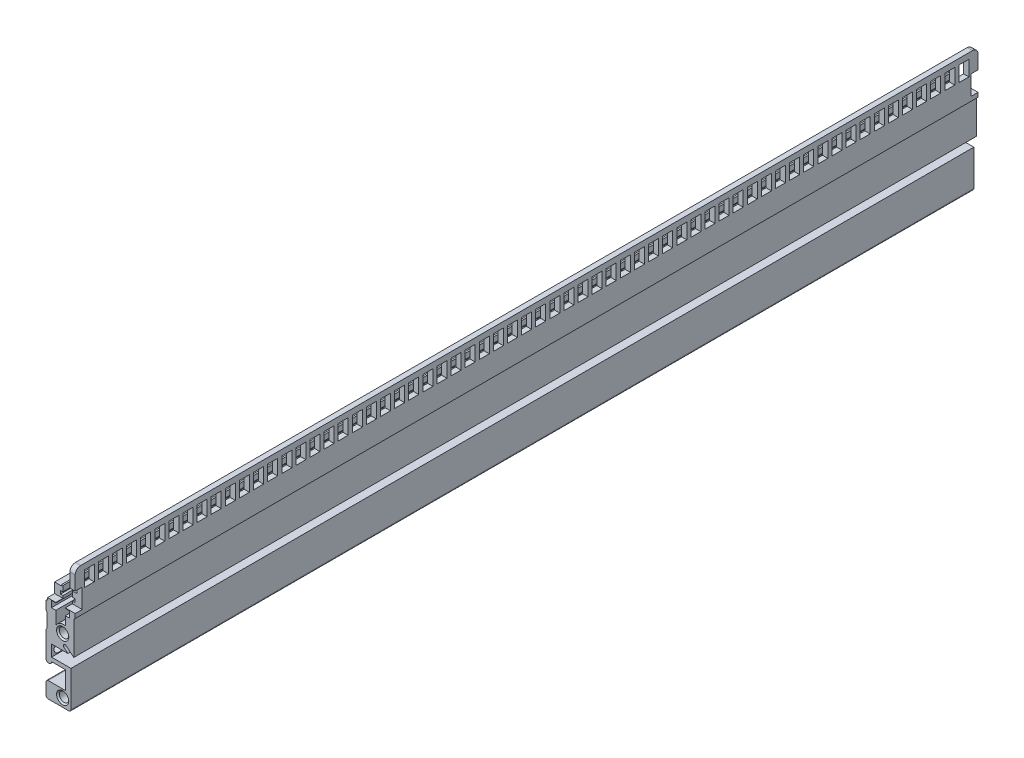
SolidWorks part; units mm, degrees
ref_plane "前视基准面" through (0, 0, 0) normal (0, 0, 1) x (1, 0, 0)
ref_plane "上视基准面" through (0, 0, 0) normal (0, 1, 0) x (1, 0, 0)
ref_plane "右视基准面" through (0, 0, 0) normal (1, 0, 0) x (0, 0, -1)
sketch "草图1" plane through (0, 0, 0) normal (0, 0, 1) x (1, 0, 0)
  line L0 (2.6, 12.5) -> (2.6, 22.5)
  line L1 (0.95, 12.5) -> (2.6, 12.5)
  line L2 (2.6, 22.5) -> (4.5, 22.5)
  line L3 (0.95, 10.55) -> (0.95, 12.5)
  line L4 (4.5, 22.5) -> (4.5, 6.95)
  line L5 (1.85, 10.55) -> (0.95, 10.55)
  line L6 (4, 6.45) -> (4.5, 6.95)
  line L7 (1.85, 9.35) -> (1.85, 10.55)
  line L8 (4, 6.45) -> (4, -5.4458)
  line L9 (0.95, 9.35) -> (1.85, 9.35)
  line L10 (1.2224, -3.1152) -> (4, -5.4458)
  line L11 (0.95, 8.35) -> (0.95, 9.35)
  line L12 (2.55, 8.35) -> (0.95, 8.35)
  line L13 (0.4511, -4.0344) -> (1.8998, -5.25)
  line L14 (2.55, 6.05) -> (2.55, 8.35)
  line L15 (-4, -5.25) -> (1.8998, -5.25)
  line L16 (0.95, 6.05) -> (2.55, 6.05)
  line L17 (-4, -9.35) -> (-4, -5.25)
  line L18 (0.95, 2.9172) -> (0.95, 6.05)
  line L19 (-4, -9.35) -> (3, -9.35)
  line L20 (3, -9.35) -> (3, -22.2)
  line L21 (-2.45, 6.05) -> (-2.45, 1.3077)
  line L22 (-4.05, 6.05) -> (-2.45, 6.05)
  line L23 (2.2, -23) -> (-5.2, -23)
  line L24 (-4.05, 8.35) -> (-4.05, 6.05)
  line L25 (-2.45, 8.35) -> (-4.05, 8.35)
  line L26 (-6, -22.2) -> (-6, -18.05)
  line L27 (-2.45, 9.35) -> (-2.45, 8.35)
  line L28 (-3.35, 9.35) -> (-2.45, 9.35)
  line L29 (-5.2, -17.25) -> (1, -17.25)
  line L30 (-3.35, 10.55) -> (-3.35, 9.35)
  line L31 (1, -10.75) -> (1, -17.25)
  line L32 (-2.45, 10.55) -> (-3.35, 10.55)
  line L33 (-4, -10.75) -> (1, -10.75)
  line L34 (-2.45, 12.5) -> (-2.45, 10.55)
  line L35 (-2.45, 12.5) -> (-3, 12.5)
  line L36 (-6, -10.75) -> (-6, -1.6)
  line L37 (-3, 12.5) -> (-3, 12.1)
  line L38 (-6, -1.6) -> (-5.5501, -1.1002)
  line L39 (-3, 12.1) -> (-5.45, 12.1)
  line L40 (-5.5499, 3.8998) -> (-5.5501, -1.1002)
  line L41 (-5.45, 12.1) -> (-5.45, 7.7)
  line L42 (-5.5499, 3.8998) -> (-6, 4.4)
  line L43 (-5.45, 7.7) -> (-5.7, 7.7)
  line L44 (-6, 4.4) -> (-6, 7.4)
  line L45 (-6, 7.4) -> (-5.7, 7.7)
  circle A0 centre (0, 0) radius 1.7
  circle A1 centre (0, -20) radius 1.7
  arc A2 (1.2224, -3.1152) -> (0.4511, -4.0344) centre (0.8368, -3.5748) ccw
  arc A3 (0.95, 2.9172) -> (-2.45, 1.3077) centre (0.25, 0) ccw
  arc A4 (2.2, -23) -> (3, -22.2) centre (2.2, -22.2) ccw
  arc A5 (-6, -22.2) -> (-5.2, -23) centre (-5.2, -22.2) ccw
  arc A6 (-5.2, -17.25) -> (-6, -18.05) centre (-5.2, -18.05) ccw
  arc A7 (-6, -10.75) -> (-4, -10.75) centre (-5, -10.75) ccw
extrude "凸台-拉伸1" add sketch "草图1" against normal blind 325.12
fillet "圆角1" radius 2 2 edges at (3.55, 22.5, -325.12) (3.55, 22.5, 0)
sketch "草图2" plane through (4.5, 0, 0) normal (1, 0, 0) x (0, 0, -1)
  line L0 (8.36, 20.45) -> (11.96, 20.45)
  line L1 (3.28, 20.45) -> (6.88, 20.45)
  line L2 (3.28, 20.45) -> (3.28, 14.95)
  line L3 (3.28, 14.95) -> (6.88, 14.95)
  line L4 (6.88, 20.45) -> (6.88, 14.95)
  line L5 (5.08, 20.45) -> (5.08, 14.95) construction
  line L6 (3.28, 17.7) -> (6.88, 17.7) construction
  line L7 (323.12, 22.5) -> (2, 22.5) construction
  line L8 (0, 20.5) -> (0, 12.5) construction
  line L9 (8.36, 20.45) -> (8.36, 14.95)
  line L10 (8.36, 14.95) -> (11.96, 14.95)
  line L11 (11.96, 20.45) -> (11.96, 14.95)
  line L12 (10.16, 20.45) -> (10.16, 14.95) construction
  line L13 (8.36, 17.7) -> (11.96, 17.7) construction
  line L14 (13.44, 20.45) -> (17.04, 20.45)
  line L15 (13.44, 20.45) -> (13.44, 14.95)
  line L16 (13.44, 14.95) -> (17.04, 14.95)
  line L17 (17.04, 20.45) -> (17.04, 14.95)
  line L18 (15.24, 20.45) -> (15.24, 14.95) construction
  line L19 (13.44, 17.7) -> (17.04, 17.7) construction
  line L20 (18.52, 20.45) -> (22.12, 20.45)
  line L21 (18.52, 20.45) -> (18.52, 14.95)
  line L22 (18.52, 14.95) -> (22.12, 14.95)
  line L23 (22.12, 20.45) -> (22.12, 14.95)
  line L24 (20.32, 20.45) -> (20.32, 14.95) construction
  line L25 (18.52, 17.7) -> (22.12, 17.7) construction
  line L26 (23.6, 20.45) -> (27.2, 20.45)
  line L27 (23.6, 20.45) -> (23.6, 14.95)
  line L28 (23.6, 14.95) -> (27.2, 14.95)
  line L29 (27.2, 20.45) -> (27.2, 14.95)
  line L30 (25.4, 20.45) -> (25.4, 14.95) construction
  line L31 (23.6, 17.7) -> (27.2, 17.7) construction
  line L32 (28.68, 20.45) -> (32.28, 20.45)
  line L33 (28.68, 20.45) -> (28.68, 14.95)
  line L34 (28.68, 14.95) -> (32.28, 14.95)
  line L35 (32.28, 20.45) -> (32.28, 14.95)
  line L36 (30.48, 20.45) -> (30.48, 14.95) construction
  line L37 (28.68, 17.7) -> (32.28, 17.7) construction
  line L38 (33.76, 20.45) -> (37.36, 20.45)
  line L39 (33.76, 20.45) -> (33.76, 14.95)
  line L40 (33.76, 14.95) -> (37.36, 14.95)
  line L41 (37.36, 20.45) -> (37.36, 14.95)
  line L42 (35.56, 20.45) -> (35.56, 14.95) construction
  line L43 (33.76, 17.7) -> (37.36, 17.7) construction
  line L44 (38.84, 20.45) -> (42.44, 20.45)
  line L45 (38.84, 20.45) -> (38.84, 14.95)
  line L46 (38.84, 14.95) -> (42.44, 14.95)
  line L47 (42.44, 20.45) -> (42.44, 14.95)
  line L48 (40.64, 20.45) -> (40.64, 14.95) construction
  line L49 (38.84, 17.7) -> (42.44, 17.7) construction
  line L50 (43.92, 20.45) -> (47.52, 20.45)
  line L51 (43.92, 20.45) -> (43.92, 14.95)
  line L52 (43.92, 14.95) -> (47.52, 14.95)
  line L53 (47.52, 20.45) -> (47.52, 14.95)
  line L54 (45.72, 20.45) -> (45.72, 14.95) construction
  line L55 (43.92, 17.7) -> (47.52, 17.7) construction
  line L56 (49, 20.45) -> (52.6, 20.45)
  line L57 (49, 20.45) -> (49, 14.95)
  line L58 (49, 14.95) -> (52.6, 14.95)
  line L59 (52.6, 20.45) -> (52.6, 14.95)
  line L60 (50.8, 20.45) -> (50.8, 14.95) construction
  line L61 (49, 17.7) -> (52.6, 17.7) construction
  line L62 (54.08, 20.45) -> (57.68, 20.45)
  line L63 (54.08, 20.45) -> (54.08, 14.95)
  line L64 (54.08, 14.95) -> (57.68, 14.95)
  line L65 (57.68, 20.45) -> (57.68, 14.95)
  line L66 (55.88, 20.45) -> (55.88, 14.95) construction
  line L67 (54.08, 17.7) -> (57.68, 17.7) construction
  line L68 (59.16, 20.45) -> (62.76, 20.45)
  line L69 (59.16, 20.45) -> (59.16, 14.95)
  line L70 (59.16, 14.95) -> (62.76, 14.95)
  line L71 (62.76, 20.45) -> (62.76, 14.95)
  line L72 (60.96, 20.45) -> (60.96, 14.95) construction
  line L73 (59.16, 17.7) -> (62.76, 17.7) construction
  line L74 (64.24, 20.45) -> (67.84, 20.45)
  line L75 (64.24, 20.45) -> (64.24, 14.95)
  line L76 (64.24, 14.95) -> (67.84, 14.95)
  line L77 (67.84, 20.45) -> (67.84, 14.95)
  line L78 (66.04, 20.45) -> (66.04, 14.95) construction
  line L79 (64.24, 17.7) -> (67.84, 17.7) construction
  line L80 (69.32, 20.45) -> (72.92, 20.45)
  line L81 (69.32, 20.45) -> (69.32, 14.95)
  line L82 (69.32, 14.95) -> (72.92, 14.95)
  line L83 (72.92, 20.45) -> (72.92, 14.95)
  line L84 (71.12, 20.45) -> (71.12, 14.95) construction
  line L85 (69.32, 17.7) -> (72.92, 17.7) construction
  line L86 (74.4, 20.45) -> (78, 20.45)
  line L87 (74.4, 20.45) -> (74.4, 14.95)
  line L88 (74.4, 14.95) -> (78, 14.95)
  line L89 (78, 20.45) -> (78, 14.95)
  line L90 (76.2, 20.45) -> (76.2, 14.95) construction
  line L91 (74.4, 17.7) -> (78, 17.7) construction
  line L92 (79.48, 20.45) -> (83.08, 20.45)
  line L93 (79.48, 20.45) -> (79.48, 14.95)
  line L94 (79.48, 14.95) -> (83.08, 14.95)
  line L95 (83.08, 20.45) -> (83.08, 14.95)
  line L96 (81.28, 20.45) -> (81.28, 14.95) construction
  line L97 (79.48, 17.7) -> (83.08, 17.7) construction
  line L98 (84.56, 20.45) -> (88.16, 20.45)
  line L99 (84.56, 20.45) -> (84.56, 14.95)
  line L100 (84.56, 14.95) -> (88.16, 14.95)
  line L101 (88.16, 20.45) -> (88.16, 14.95)
  line L102 (86.36, 20.45) -> (86.36, 14.95) construction
  line L103 (84.56, 17.7) -> (88.16, 17.7) construction
  line L104 (89.64, 20.45) -> (93.24, 20.45)
  line L105 (89.64, 20.45) -> (89.64, 14.95)
  line L106 (89.64, 14.95) -> (93.24, 14.95)
  line L107 (93.24, 20.45) -> (93.24, 14.95)
  line L108 (91.44, 20.45) -> (91.44, 14.95) construction
  line L109 (89.64, 17.7) -> (93.24, 17.7) construction
  line L110 (94.72, 20.45) -> (98.32, 20.45)
  line L111 (94.72, 20.45) -> (94.72, 14.95)
  line L112 (94.72, 14.95) -> (98.32, 14.95)
  line L113 (98.32, 20.45) -> (98.32, 14.95)
  line L114 (96.52, 20.45) -> (96.52, 14.95) construction
  line L115 (94.72, 17.7) -> (98.32, 17.7) construction
  line L116 (99.8, 20.45) -> (103.4, 20.45)
  line L117 (99.8, 20.45) -> (99.8, 14.95)
  line L118 (99.8, 14.95) -> (103.4, 14.95)
  line L119 (103.4, 20.45) -> (103.4, 14.95)
  line L120 (101.6, 20.45) -> (101.6, 14.95) construction
  line L121 (99.8, 17.7) -> (103.4, 17.7) construction
  line L122 (104.88, 20.45) -> (108.48, 20.45)
  line L123 (104.88, 20.45) -> (104.88, 14.95)
  line L124 (104.88, 14.95) -> (108.48, 14.95)
  line L125 (108.48, 20.45) -> (108.48, 14.95)
  line L126 (106.68, 20.45) -> (106.68, 14.95) construction
  line L127 (104.88, 17.7) -> (108.48, 17.7) construction
  line L128 (109.96, 20.45) -> (113.56, 20.45)
  line L129 (109.96, 20.45) -> (109.96, 14.95)
  line L130 (109.96, 14.95) -> (113.56, 14.95)
  line L131 (113.56, 20.45) -> (113.56, 14.95)
  line L132 (111.76, 20.45) -> (111.76, 14.95) construction
  line L133 (109.96, 17.7) -> (113.56, 17.7) construction
  line L134 (115.04, 20.45) -> (118.64, 20.45)
  line L135 (115.04, 20.45) -> (115.04, 14.95)
  line L136 (115.04, 14.95) -> (118.64, 14.95)
  line L137 (118.64, 20.45) -> (118.64, 14.95)
  line L138 (116.84, 20.45) -> (116.84, 14.95) construction
  line L139 (115.04, 17.7) -> (118.64, 17.7) construction
  line L140 (120.12, 20.45) -> (123.72, 20.45)
  line L141 (120.12, 20.45) -> (120.12, 14.95)
  line L142 (120.12, 14.95) -> (123.72, 14.95)
  line L143 (123.72, 20.45) -> (123.72, 14.95)
  line L144 (121.92, 20.45) -> (121.92, 14.95) construction
  line L145 (120.12, 17.7) -> (123.72, 17.7) construction
  line L146 (125.2, 20.45) -> (128.8, 20.45)
  line L147 (125.2, 20.45) -> (125.2, 14.95)
  line L148 (125.2, 14.95) -> (128.8, 14.95)
  line L149 (128.8, 20.45) -> (128.8, 14.95)
  line L150 (127, 20.45) -> (127, 14.95) construction
  line L151 (125.2, 17.7) -> (128.8, 17.7) construction
  line L152 (130.28, 20.45) -> (133.88, 20.45)
  line L153 (130.28, 20.45) -> (130.28, 14.95)
  line L154 (130.28, 14.95) -> (133.88, 14.95)
  line L155 (133.88, 20.45) -> (133.88, 14.95)
  line L156 (132.08, 20.45) -> (132.08, 14.95) construction
  line L157 (130.28, 17.7) -> (133.88, 17.7) construction
  line L158 (135.36, 20.45) -> (138.96, 20.45)
  line L159 (135.36, 20.45) -> (135.36, 14.95)
  line L160 (135.36, 14.95) -> (138.96, 14.95)
  line L161 (138.96, 20.45) -> (138.96, 14.95)
  line L162 (137.16, 20.45) -> (137.16, 14.95) construction
  line L163 (135.36, 17.7) -> (138.96, 17.7) construction
  line L164 (140.44, 20.45) -> (144.04, 20.45)
  line L165 (140.44, 20.45) -> (140.44, 14.95)
  line L166 (140.44, 14.95) -> (144.04, 14.95)
  line L167 (144.04, 20.45) -> (144.04, 14.95)
  line L168 (142.24, 20.45) -> (142.24, 14.95) construction
  line L169 (140.44, 17.7) -> (144.04, 17.7) construction
  line L170 (145.52, 20.45) -> (149.12, 20.45)
  line L171 (145.52, 20.45) -> (145.52, 14.95)
  line L172 (145.52, 14.95) -> (149.12, 14.95)
  line L173 (149.12, 20.45) -> (149.12, 14.95)
  line L174 (147.32, 20.45) -> (147.32, 14.95) construction
  line L175 (145.52, 17.7) -> (149.12, 17.7) construction
  line L176 (150.6, 20.45) -> (154.2, 20.45)
  line L177 (150.6, 20.45) -> (150.6, 14.95)
  line L178 (150.6, 14.95) -> (154.2, 14.95)
  line L179 (154.2, 20.45) -> (154.2, 14.95)
  line L180 (152.4, 20.45) -> (152.4, 14.95) construction
  line L181 (150.6, 17.7) -> (154.2, 17.7) construction
  line L182 (155.68, 20.45) -> (159.28, 20.45)
  line L183 (155.68, 20.45) -> (155.68, 14.95)
  line L184 (155.68, 14.95) -> (159.28, 14.95)
  line L185 (159.28, 20.45) -> (159.28, 14.95)
  line L186 (157.48, 20.45) -> (157.48, 14.95) construction
  line L187 (155.68, 17.7) -> (159.28, 17.7) construction
  line L188 (160.76, 20.45) -> (164.36, 20.45)
  line L189 (160.76, 20.45) -> (160.76, 14.95)
  line L190 (160.76, 14.95) -> (164.36, 14.95)
  line L191 (164.36, 20.45) -> (164.36, 14.95)
  line L192 (162.56, 20.45) -> (162.56, 14.95) construction
  line L193 (160.76, 17.7) -> (164.36, 17.7) construction
  line L194 (165.84, 20.45) -> (169.44, 20.45)
  line L195 (165.84, 20.45) -> (165.84, 14.95)
  line L196 (165.84, 14.95) -> (169.44, 14.95)
  line L197 (169.44, 20.45) -> (169.44, 14.95)
  line L198 (167.64, 20.45) -> (167.64, 14.95) construction
  line L199 (165.84, 17.7) -> (169.44, 17.7) construction
  line L200 (170.92, 20.45) -> (174.52, 20.45)
  line L201 (170.92, 20.45) -> (170.92, 14.95)
  line L202 (170.92, 14.95) -> (174.52, 14.95)
  line L203 (174.52, 20.45) -> (174.52, 14.95)
  line L204 (172.72, 20.45) -> (172.72, 14.95) construction
  line L205 (170.92, 17.7) -> (174.52, 17.7) construction
  line L206 (176, 20.45) -> (179.6, 20.45)
  line L207 (176, 20.45) -> (176, 14.95)
  line L208 (176, 14.95) -> (179.6, 14.95)
  line L209 (179.6, 20.45) -> (179.6, 14.95)
  line L210 (177.8, 20.45) -> (177.8, 14.95) construction
  line L211 (176, 17.7) -> (179.6, 17.7) construction
  line L212 (181.08, 20.45) -> (184.68, 20.45)
  line L213 (181.08, 20.45) -> (181.08, 14.95)
  line L214 (181.08, 14.95) -> (184.68, 14.95)
  line L215 (184.68, 20.45) -> (184.68, 14.95)
  line L216 (182.88, 20.45) -> (182.88, 14.95) construction
  line L217 (181.08, 17.7) -> (184.68, 17.7) construction
  line L218 (186.16, 20.45) -> (189.76, 20.45)
  line L219 (186.16, 20.45) -> (186.16, 14.95)
  line L220 (186.16, 14.95) -> (189.76, 14.95)
  line L221 (189.76, 20.45) -> (189.76, 14.95)
  line L222 (187.96, 20.45) -> (187.96, 14.95) construction
  line L223 (186.16, 17.7) -> (189.76, 17.7) construction
  line L224 (191.24, 20.45) -> (194.84, 20.45)
  line L225 (191.24, 20.45) -> (191.24, 14.95)
  line L226 (191.24, 14.95) -> (194.84, 14.95)
  line L227 (194.84, 20.45) -> (194.84, 14.95)
  line L228 (193.04, 20.45) -> (193.04, 14.95) construction
  line L229 (191.24, 17.7) -> (194.84, 17.7) construction
  line L230 (196.32, 20.45) -> (199.92, 20.45)
  line L231 (196.32, 20.45) -> (196.32, 14.95)
  line L232 (196.32, 14.95) -> (199.92, 14.95)
  line L233 (199.92, 20.45) -> (199.92, 14.95)
  line L234 (198.12, 20.45) -> (198.12, 14.95) construction
  line L235 (196.32, 17.7) -> (199.92, 17.7) construction
  line L236 (201.4, 20.45) -> (205, 20.45)
  line L237 (201.4, 20.45) -> (201.4, 14.95)
  line L238 (201.4, 14.95) -> (205, 14.95)
  line L239 (205, 20.45) -> (205, 14.95)
  line L240 (203.2, 20.45) -> (203.2, 14.95) construction
  line L241 (201.4, 17.7) -> (205, 17.7) construction
  line L242 (206.48, 20.45) -> (210.08, 20.45)
  line L243 (206.48, 20.45) -> (206.48, 14.95)
  line L244 (206.48, 14.95) -> (210.08, 14.95)
  line L245 (210.08, 20.45) -> (210.08, 14.95)
  line L246 (208.28, 20.45) -> (208.28, 14.95) construction
  line L247 (206.48, 17.7) -> (210.08, 17.7) construction
  line L248 (211.56, 20.45) -> (215.16, 20.45)
  line L249 (211.56, 20.45) -> (211.56, 14.95)
  line L250 (211.56, 14.95) -> (215.16, 14.95)
  line L251 (215.16, 20.45) -> (215.16, 14.95)
  line L252 (213.36, 20.45) -> (213.36, 14.95) construction
  line L253 (211.56, 17.7) -> (215.16, 17.7) construction
  line L254 (216.64, 20.45) -> (220.24, 20.45)
  line L255 (216.64, 20.45) -> (216.64, 14.95)
  line L256 (216.64, 14.95) -> (220.24, 14.95)
  line L257 (220.24, 20.45) -> (220.24, 14.95)
  line L258 (218.44, 20.45) -> (218.44, 14.95) construction
  line L259 (216.64, 17.7) -> (220.24, 17.7) construction
  line L260 (221.72, 20.45) -> (225.32, 20.45)
  line L261 (221.72, 20.45) -> (221.72, 14.95)
  line L262 (221.72, 14.95) -> (225.32, 14.95)
  line L263 (225.32, 20.45) -> (225.32, 14.95)
  line L264 (223.52, 20.45) -> (223.52, 14.95) construction
  line L265 (221.72, 17.7) -> (225.32, 17.7) construction
  line L266 (226.8, 20.45) -> (230.4, 20.45)
  line L267 (226.8, 20.45) -> (226.8, 14.95)
  line L268 (226.8, 14.95) -> (230.4, 14.95)
  line L269 (230.4, 20.45) -> (230.4, 14.95)
  line L270 (228.6, 20.45) -> (228.6, 14.95) construction
  line L271 (226.8, 17.7) -> (230.4, 17.7) construction
  line L272 (231.88, 20.45) -> (235.48, 20.45)
  line L273 (231.88, 20.45) -> (231.88, 14.95)
  line L274 (231.88, 14.95) -> (235.48, 14.95)
  line L275 (235.48, 20.45) -> (235.48, 14.95)
  line L276 (233.68, 20.45) -> (233.68, 14.95) construction
  line L277 (231.88, 17.7) -> (235.48, 17.7) construction
  line L278 (236.96, 20.45) -> (240.56, 20.45)
  line L279 (236.96, 20.45) -> (236.96, 14.95)
  line L280 (236.96, 14.95) -> (240.56, 14.95)
  line L281 (240.56, 20.45) -> (240.56, 14.95)
  line L282 (238.76, 20.45) -> (238.76, 14.95) construction
  line L283 (236.96, 17.7) -> (240.56, 17.7) construction
  line L284 (242.04, 20.45) -> (245.64, 20.45)
  line L285 (242.04, 20.45) -> (242.04, 14.95)
  line L286 (242.04, 14.95) -> (245.64, 14.95)
  line L287 (245.64, 20.45) -> (245.64, 14.95)
  line L288 (243.84, 20.45) -> (243.84, 14.95) construction
  line L289 (242.04, 17.7) -> (245.64, 17.7) construction
  line L290 (247.12, 20.45) -> (250.72, 20.45)
  line L291 (247.12, 20.45) -> (247.12, 14.95)
  line L292 (247.12, 14.95) -> (250.72, 14.95)
  line L293 (250.72, 20.45) -> (250.72, 14.95)
  line L294 (248.92, 20.45) -> (248.92, 14.95) construction
  line L295 (247.12, 17.7) -> (250.72, 17.7) construction
  line L296 (252.2, 20.45) -> (255.8, 20.45)
  line L297 (252.2, 20.45) -> (252.2, 14.95)
  line L298 (252.2, 14.95) -> (255.8, 14.95)
  line L299 (255.8, 20.45) -> (255.8, 14.95)
  line L300 (254, 20.45) -> (254, 14.95) construction
  line L301 (252.2, 17.7) -> (255.8, 17.7) construction
  line L302 (257.28, 20.45) -> (260.88, 20.45)
  line L303 (257.28, 20.45) -> (257.28, 14.95)
  line L304 (257.28, 14.95) -> (260.88, 14.95)
  line L305 (260.88, 20.45) -> (260.88, 14.95)
  line L306 (259.08, 20.45) -> (259.08, 14.95) construction
  line L307 (257.28, 17.7) -> (260.88, 17.7) construction
  line L308 (262.36, 20.45) -> (265.96, 20.45)
  line L309 (262.36, 20.45) -> (262.36, 14.95)
  line L310 (262.36, 14.95) -> (265.96, 14.95)
  line L311 (265.96, 20.45) -> (265.96, 14.95)
  line L312 (264.16, 20.45) -> (264.16, 14.95) construction
  line L313 (262.36, 17.7) -> (265.96, 17.7) construction
  line L314 (267.44, 20.45) -> (271.04, 20.45)
  line L315 (267.44, 20.45) -> (267.44, 14.95)
  line L316 (267.44, 14.95) -> (271.04, 14.95)
  line L317 (271.04, 20.45) -> (271.04, 14.95)
  line L318 (269.24, 20.45) -> (269.24, 14.95) construction
  line L319 (267.44, 17.7) -> (271.04, 17.7) construction
  line L320 (272.52, 20.45) -> (276.12, 20.45)
  line L321 (272.52, 20.45) -> (272.52, 14.95)
  line L322 (272.52, 14.95) -> (276.12, 14.95)
  line L323 (276.12, 20.45) -> (276.12, 14.95)
  line L324 (274.32, 20.45) -> (274.32, 14.95) construction
  line L325 (272.52, 17.7) -> (276.12, 17.7) construction
  line L326 (277.6, 20.45) -> (281.2, 20.45)
  line L327 (277.6, 20.45) -> (277.6, 14.95)
  line L328 (277.6, 14.95) -> (281.2, 14.95)
  line L329 (281.2, 20.45) -> (281.2, 14.95)
  line L330 (279.4, 20.45) -> (279.4, 14.95) construction
  line L331 (277.6, 17.7) -> (281.2, 17.7) construction
  line L332 (282.68, 20.45) -> (286.28, 20.45)
  line L333 (282.68, 20.45) -> (282.68, 14.95)
  line L334 (282.68, 14.95) -> (286.28, 14.95)
  line L335 (286.28, 20.45) -> (286.28, 14.95)
  line L336 (284.48, 20.45) -> (284.48, 14.95) construction
  line L337 (282.68, 17.7) -> (286.28, 17.7) construction
  line L338 (287.76, 20.45) -> (291.36, 20.45)
  line L339 (287.76, 20.45) -> (287.76, 14.95)
  line L340 (287.76, 14.95) -> (291.36, 14.95)
  line L341 (291.36, 20.45) -> (291.36, 14.95)
  line L342 (289.56, 20.45) -> (289.56, 14.95) construction
  line L343 (287.76, 17.7) -> (291.36, 17.7) construction
  line L344 (292.84, 20.45) -> (296.44, 20.45)
  line L345 (292.84, 20.45) -> (292.84, 14.95)
  line L346 (292.84, 14.95) -> (296.44, 14.95)
  line L347 (296.44, 20.45) -> (296.44, 14.95)
  line L348 (294.64, 20.45) -> (294.64, 14.95) construction
  line L349 (292.84, 17.7) -> (296.44, 17.7) construction
  line L350 (297.92, 20.45) -> (301.52, 20.45)
  line L351 (297.92, 20.45) -> (297.92, 14.95)
  line L352 (297.92, 14.95) -> (301.52, 14.95)
  line L353 (301.52, 20.45) -> (301.52, 14.95)
  line L354 (299.72, 20.45) -> (299.72, 14.95) construction
  line L355 (297.92, 17.7) -> (301.52, 17.7) construction
  line L356 (303, 20.45) -> (306.6, 20.45)
  line L357 (303, 20.45) -> (303, 14.95)
  line L358 (303, 14.95) -> (306.6, 14.95)
  line L359 (306.6, 20.45) -> (306.6, 14.95)
  line L360 (304.8, 20.45) -> (304.8, 14.95) construction
  line L361 (303, 17.7) -> (306.6, 17.7) construction
  line L362 (308.08, 20.45) -> (311.68, 20.45)
  line L363 (308.08, 20.45) -> (308.08, 14.95)
  line L364 (308.08, 14.95) -> (311.68, 14.95)
  line L365 (311.68, 20.45) -> (311.68, 14.95)
  line L366 (309.88, 20.45) -> (309.88, 14.95) construction
  line L367 (308.08, 17.7) -> (311.68, 17.7) construction
  line L368 (313.16, 20.45) -> (316.76, 20.45)
  line L369 (313.16, 20.45) -> (313.16, 14.95)
  line L370 (313.16, 14.95) -> (316.76, 14.95)
  line L371 (316.76, 20.45) -> (316.76, 14.95)
  line L372 (314.96, 20.45) -> (314.96, 14.95) construction
  line L373 (313.16, 17.7) -> (316.76, 17.7) construction
  line L374 (318.24, 20.45) -> (321.84, 20.45)
  line L375 (318.24, 20.45) -> (318.24, 14.95)
  line L376 (318.24, 14.95) -> (321.84, 14.95)
  line L377 (321.84, 20.45) -> (321.84, 14.95)
  line L378 (320.04, 20.45) -> (320.04, 14.95) construction
  line L379 (318.24, 17.7) -> (321.84, 17.7) construction
extrude "切除-拉伸1" cut sketch "草图2" against normal up to next (1.9 mm away)
sketch "草图3" plane through (4.5, 0, 0) normal (1, 0, 0) x (0, 0, -1)
  line L0 (323.12, 22.5) -> (2, 22.5) construction
  line L1 (0, 15.5) -> (2.54, 15.5)
  line L2 (0, 15.5) -> (0, 8.5)
  line L3 (0, 8.5) -> (2.54, 8.5)
  line L4 (2.54, 15.5) -> (2.54, 8.5)
  line L6 (0, 6.95) -> (0, 20.5) construction
  dimension "D1" = 7
  dimension "D2" = 2.54
  dimension "D3" = 7
  dimension "D4" = 0
extrude "切除-拉伸2" cut sketch "草图3" against normal through all
ref_plane "基准面2" through (0, 0, -162.56) normal (0, 0, 1) x (1, 0, 0)
mirror "镜向1" about plane through (0, 0, -162.56) normal (0, 0, 1) of "切除-拉伸2"
sketch "草图4" plane through (-6, 0, 0) normal (-1, 0, 0) x (0, 0, 1)
  line L0 (-325.12, -1.6) -> (-325.12, -10.75) construction
  line L1 (-325.12, -9.35) -> (0, -9.35) construction
  circle A0 centre (-322.58, -7.45) radius 1.65
  circle A1 centre (-317.5, -7.45) radius 1.65
  circle A2 centre (-312.42, -7.45) radius 1.65
  circle A3 centre (-307.34, -7.45) radius 1.65
  circle A4 centre (-302.26, -7.45) radius 1.65
  circle A5 centre (-297.18, -7.45) radius 1.65
  circle A6 centre (-292.1, -7.45) radius 1.65
  circle A7 centre (-287.02, -7.45) radius 1.65
  circle A8 centre (-281.94, -7.45) radius 1.65
  circle A9 centre (-276.86, -7.45) radius 1.65
  circle A10 centre (-271.78, -7.45) radius 1.65
  circle A11 centre (-266.7, -7.45) radius 1.65
  circle A12 centre (-261.62, -7.45) radius 1.65
  circle A13 centre (-256.54, -7.45) radius 1.65
  circle A14 centre (-251.46, -7.45) radius 1.65
  circle A15 centre (-246.38, -7.45) radius 1.65
  circle A16 centre (-241.3, -7.45) radius 1.65
  circle A17 centre (-236.22, -7.45) radius 1.65
  circle A18 centre (-231.14, -7.45) radius 1.65
  circle A19 centre (-226.06, -7.45) radius 1.65
  circle A20 centre (-220.98, -7.45) radius 1.65
  circle A21 centre (-215.9, -7.45) radius 1.65
  circle A22 centre (-210.82, -7.45) radius 1.65
  circle A23 centre (-205.74, -7.45) radius 1.65
  circle A24 centre (-200.66, -7.45) radius 1.65
  circle A25 centre (-195.58, -7.45) radius 1.65
  circle A26 centre (-190.5, -7.45) radius 1.65
  circle A27 centre (-185.42, -7.45) radius 1.65
  circle A28 centre (-180.34, -7.45) radius 1.65
  circle A29 centre (-175.26, -7.45) radius 1.65
  circle A30 centre (-170.18, -7.45) radius 1.65
  circle A31 centre (-165.1, -7.45) radius 1.65
  circle A32 centre (-160.02, -7.45) radius 1.65
  circle A33 centre (-154.94, -7.45) radius 1.65
  circle A34 centre (-149.86, -7.45) radius 1.65
  circle A35 centre (-144.78, -7.45) radius 1.65
  circle A36 centre (-139.7, -7.45) radius 1.65
  circle A37 centre (-134.62, -7.45) radius 1.65
  circle A38 centre (-129.54, -7.45) radius 1.65
  circle A39 centre (-124.46, -7.45) radius 1.65
  circle A40 centre (-119.38, -7.45) radius 1.65
  circle A41 centre (-114.3, -7.45) radius 1.65
  circle A42 centre (-109.22, -7.45) radius 1.65
  circle A43 centre (-104.14, -7.45) radius 1.65
  circle A44 centre (-99.06, -7.45) radius 1.65
  circle A45 centre (-93.98, -7.45) radius 1.65
  circle A46 centre (-88.9, -7.45) radius 1.65
  circle A47 centre (-83.82, -7.45) radius 1.65
  circle A48 centre (-78.74, -7.45) radius 1.65
  circle A49 centre (-73.66, -7.45) radius 1.65
  circle A50 centre (-68.58, -7.45) radius 1.65
  circle A51 centre (-63.5, -7.45) radius 1.65
  circle A52 centre (-58.42, -7.45) radius 1.65
  circle A53 centre (-53.34, -7.45) radius 1.65
  circle A54 centre (-48.26, -7.45) radius 1.65
  circle A55 centre (-43.18, -7.45) radius 1.65
  circle A56 centre (-38.1, -7.45) radius 1.65
  circle A57 centre (-33.02, -7.45) radius 1.65
  circle A58 centre (-27.94, -7.45) radius 1.65
  circle A59 centre (-22.86, -7.45) radius 1.65
  circle A60 centre (-17.78, -7.45) radius 1.65
  circle A61 centre (-12.7, -7.45) radius 1.65
  circle A62 centre (-7.62, -7.45) radius 1.65
  circle A63 centre (-2.54, -7.45) radius 1.65
extrude "切除-拉伸3" cut sketch "草图4" against normal up to next (2 mm away)
chamfer "倒角1" distance 0.5 angle 45 3 edges at (1.7, -20, 0) (1.7, 0, 0) (1.7, 0, -325.12)
chamfer "倒角2" distance 0.5 angle 45 1 edges at (1.7, -20, -325.12)
equation "\"D4@草图4\"=\"D1@凸台-拉伸1\"/5.08"
equation "\"D5@草图2\"=\"D1@凸台-拉伸1\"/5.08-1"
